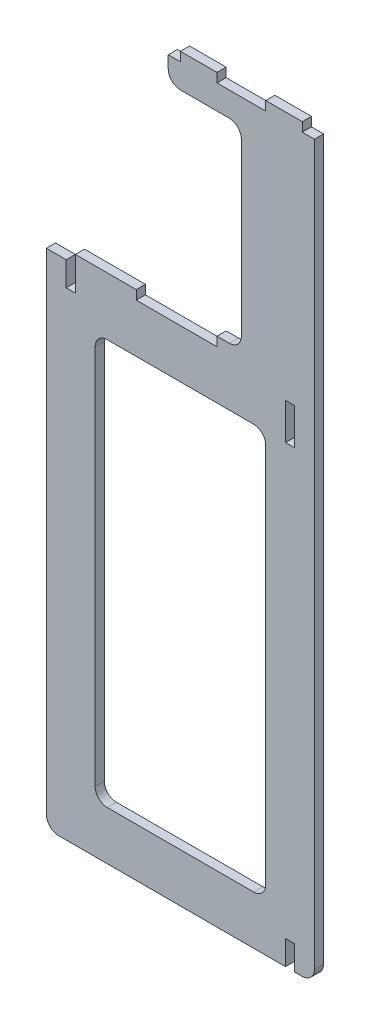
SolidWorks part; units mm, degrees
ref_plane "Front Plane" through (0, 0, 0) normal (0, 0, 1) x (1, 0, 0)
ref_plane "Top Plane" through (0, 0, 0) normal (0, 1, 0) x (1, 0, 0)
ref_plane "Right Plane" through (0, 0, 0) normal (1, 0, 0) x (0, 0, -1)
sketch "Sketch1" plane through (0, 0, 0) normal (0, 0, 1) x (1, 0, 0)
  line L1 (-279.4, 523.875) -> (279.4, 523.875)
  line L2 (-279.4, 523.875) -> (-279.4, -523.875)
  line L3 (-279.4, -523.875) -> (279.4, -523.875)
  line L4 (279.4, 523.875) -> (279.4, -523.875)
  line L5 (-279.4, 523.875) -> (279.4, -523.875) construction
  line L6 (-279.4, -523.875) -> (279.4, 523.875) construction
  point P0 (0, 0)
  dimension "D1" = 558.8
  dimension "D2" = 1047.75
extrude "bottom_extrude" add sketch "Sketch1" along normal blind 19.05
sketch "Sketch4" plane through (0, 0, 19.05) normal (0, 0, 1) x (1, 0, 0)
  line L0 (279.4, 523.875) -> (-279.4, 523.875) construction
  line L1 (-177.8, 422.275) -> (177.8, 422.275)
  line L2 (-177.8, 422.275) -> (-177.8, -422.275)
  line L3 (-177.8, -422.275) -> (177.8, -422.275)
  line L4 (177.8, 422.275) -> (177.8, -422.275)
  line L5 (-177.8, 422.275) -> (177.8, -422.275) construction
  line L6 (-177.8, -422.275) -> (177.8, 422.275) construction
  line L7 (-279.4, 523.875) -> (-279.4, -523.875) construction
  point P0 (0, 0)
  dimension "D1" = 101.6
  dimension "D2" = 101.6
extrude "interior_cut" cut sketch "Sketch4" against normal blind 19.05
sketch "Sketch5" plane through (0, 0, 19.05) normal (0, 0, 1) x (1, 0, 0)
  line L0 (279.4, 523.875) -> (-279.4, 523.875) construction
  line L1 (-238.125, 523.875) -> (-219.075, 523.875)
  line L2 (-238.125, 523.875) -> (-238.125, 473.075)
  line L3 (-238.125, 473.075) -> (-219.075, 473.075)
  line L4 (-219.075, 523.875) -> (-219.075, 473.075)
  line L10 (-279.4, 523.875) -> (-279.4, -523.875) construction
  dimension "D1" = 41.275
  dimension "D2" = 19.05
  dimension "D3" = 50.8
extrude "top_support_slot" cut sketch "Sketch5" against normal through all
sketch "Sketch7" plane through (0, 0, 19.05) normal (0, 0, 1) x (1, 0, 0)
  line L1 (-219.075, 523.875) -> (-92.075, 523.875)
  line L2 (-219.075, 523.875) -> (-219.075, 542.925)
  line L3 (-219.075, 542.925) -> (-92.075, 542.925)
  line L4 (-92.075, 523.875) -> (-92.075, 542.925)
  dimension "D1" = 19.05
  dimension "D2" = 127
extrude "front_table_tab" add sketch "Sketch7" against normal up to surface (19.05 mm away)
fillet "Fillet1" radius 25.4 2 edges at (279.4, -523.875, 9.525) (-279.4, -523.875, 9.525)
sketch "Sketch8" plane through (0, 0, 19.05) normal (0, 0, 1) x (1, 0, 0)
  line L0 (-254, -523.875) -> (254, -523.875) construction
  line L1 (219.075, -523.875) -> (238.125, -523.875)
  line L2 (219.075, -523.875) -> (219.075, -473.075)
  line L3 (219.075, -473.075) -> (238.125, -473.075)
  line L4 (238.125, -523.875) -> (238.125, -473.075)
  line L5 (279.4, -498.475) -> (279.4, 523.875) construction
  dimension "D1" = 19.05
  dimension "D2" = 50.8
  dimension "D3" = 41.275
extrude "bottom_support_slot" cut sketch "Sketch8" against normal through all
sketch "Sketch9" plane through (0, 0, 19.05) normal (0, 0, 1) x (1, 0, 0)
  line L0 (-92.075, 542.925) -> (-219.075, 542.925) construction
  line L1 (279.4, 523.875) -> (76.2, 523.875)
  line L2 (279.4, 523.875) -> (279.4, 542.925)
  line L3 (279.4, 542.925) -> (76.2, 542.925)
  line L4 (76.2, 523.875) -> (76.2, 542.925)
  line L5 (279.4, 542.925) -> (127, 542.925)
  line L6 (279.4, 542.925) -> (279.4, 949.325)
  line L7 (279.4, 949.325) -> (127, 949.325)
  line L8 (127, 542.925) -> (127, 949.325)
  dimension "D1" = 203.2
  dimension "D2" = 152.4
  dimension "D3" = 406.4
extrude "Boss-Extrude3" add sketch "Sketch9" against normal up to surface (19.05 mm away) contours L8 L3 L6 L7 | L4 L2 L3 M7
sketch "Sketch10" plane through (0, 0, 19.05) normal (0, 0, 1) x (1, 0, 0)
  line L0 (279.4, 949.325) -> (127, 949.325) construction
  line L1 (279.4, 949.325) -> (-25.4, 949.325)
  line L2 (279.4, 949.325) -> (279.4, 1000.125)
  line L3 (279.4, 1000.125) -> (-25.4, 1000.125)
  line L4 (-25.4, 949.325) -> (-25.4, 1000.125)
  line L5 (279.4, -498.475) -> (279.4, 949.325) construction
  dimension "D1" = 50.8
  dimension "D2" = 304.8
extrude "Boss-Extrude4" add sketch "Sketch10" against normal up to surface (19.05 mm away)
fillet "Fillet2" radius 25.4 1 edges at (127, 542.925, 9.525)
fillet "Fillet3" radius 25.4 2 edges at (-25.4, 949.325, 9.525)
sketch "Sketch11" plane through (0, 0, 19.05) normal (0, 0, 1) x (1, 0, 0)
  line L0 (279.4, 1000.125) -> (-25.4, 1000.125) construction
  line L1 (0, 1000.125) -> (76.2, 1000.125)
  line L2 (0, 1000.125) -> (0, 1019.175)
  line L3 (0, 1019.175) -> (76.2, 1019.175)
  line L4 (76.2, 1000.125) -> (76.2, 1019.175)
  line L5 (-25.4, 1000.125) -> (-25.4, 974.725) construction
  line L6 (177.8, 1000.125) -> (254, 1000.125)
  line L7 (177.8, 1000.125) -> (177.8, 1019.175)
  line L8 (177.8, 1019.175) -> (254, 1019.175)
  line L9 (254, 1000.125) -> (254, 1019.175)
  line L10 (279.4, -498.475) -> (279.4, 1000.125) construction
  dimension "D1" = 19.05
  dimension "D2" = 76.2
  dimension "D3" = 25.4
  dimension "D4" = 25.4
extrude "Boss-Extrude5" add sketch "Sketch11" against normal up to surface (19.05 mm away)
fillet "Fillet4" radius 25.4 4 edges at (177.8, -422.275, 9.525) (177.8, 422.275, 9.525) (-177.8, 422.275, 9.525) (-177.8, -422.275, 9.525)
sketch "Sketch12" plane through (0, 0, 19.05) normal (0, 0, 1) x (1, 0, 0)
  line L0 (76.2, 523.875) -> (-92.075, 523.875) construction
  line L1 (219.075, 498.475) -> (238.125, 498.475)
  line L2 (219.075, 498.475) -> (219.075, 422.275)
  line L3 (219.075, 422.275) -> (238.125, 422.275)
  line L4 (238.125, 498.475) -> (238.125, 422.275)
  line L5 (279.4, -498.475) -> (279.4, 1000.125) construction
  dimension "D1" = 76.2
  dimension "D2" = 19.05
  dimension "D3" = 25.4
  dimension "D4" = 41.275
extrude "Cut-Extrude5" cut sketch "Sketch12" against normal through all
